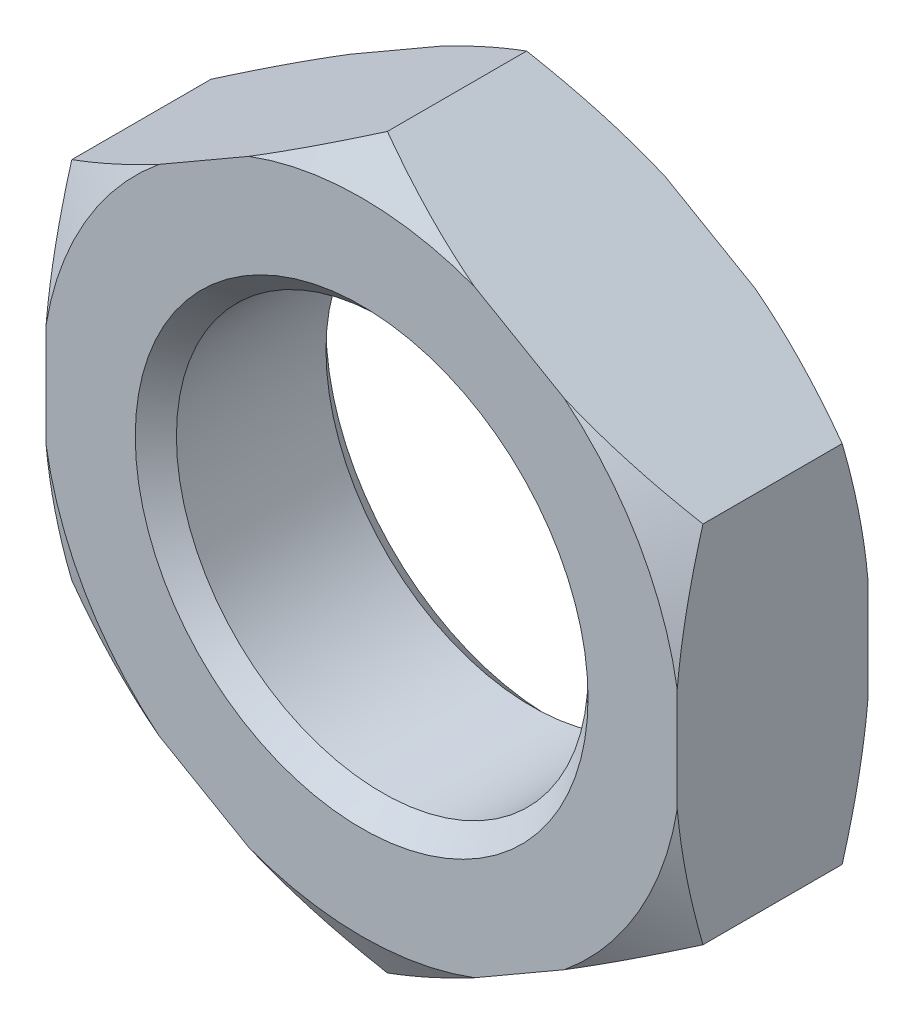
SolidWorks part; units mm, degrees
ref_plane "Front Plane" through (0, 0, 0) normal (0, 0, 1) x (1, 0, 0)
ref_plane "Top Plane" through (0, 0, 0) normal (0, 1, 0) x (1, 0, 0)
ref_plane "Right Plane" through (0, 0, 0) normal (1, 0, 0) x (0, 0, -1)
sketch "Sketch3" plane through (0, 0, 0) normal (0, 0, 1) x (1, 0, 0)
  line L1 (0, 26.5581) -> (-23, 13.2791)
  line L2 (-23, 13.2791) -> (-23, -13.2791)
  line L3 (-23, -13.2791) -> (0, -26.5581)
  line L4 (0, -26.5581) -> (23, -13.2791)
  line L5 (23, -13.2791) -> (23, 13.2791)
  line L6 (23, 13.2791) -> (0, 26.5581)
  circle A0 centre (0, 0) radius 23 construction
  dimension "D1" = 46
extrude "Boss-Extrude1" add sketch "Sketch3" along normal mid plane 13.9
sketch "Sketch4" plane through (0, 0, 0) normal (1, 0, 0) x (0, 0, -1)
  line L0 (-5.4578, 0) -> (6.1545, 0) construction
sketch "Sketch5" plane through (0, 0, 0) normal (1, 0, 0) x (0, 0, -1)
  line L0 (-6.95, 26.5581) -> (-6.95, 23.3081)
  line L1 (-6.95, 13.2791) -> (-6.95, 26.5581) construction
  line L2 (-6.95, 23.3081) -> (-5.0736, 26.5581)
  line L3 (-6.95, 26.5581) -> (6.95, 26.5581) construction
  line L4 (-5.0736, 26.5581) -> (-6.95, 26.5581)
  dimension "D1" = 3.25
  dimension "D2" = 30
revolve "Cut-Revolve1" cut sketch "Sketch5" angle 360 about L0
mirror "Mirror1" about plane through (0, 0, 0) normal (0, 0, 1) of "Cut-Revolve1"
sketch "Sketch6" plane through (0, 0, 6.95) normal (0, 0, 1) x (1, 0, 0)
  circle A0 centre (0, 0) radius 15
  dimension "D1" = 30
extrude "Cut-Extrude1" cut sketch "Sketch6" against normal blind 13.9
chamfer "Chamfer1" distance 1.5 angle 45 2 edges at (15, 0, -6.95) (15, 0, 6.95)
